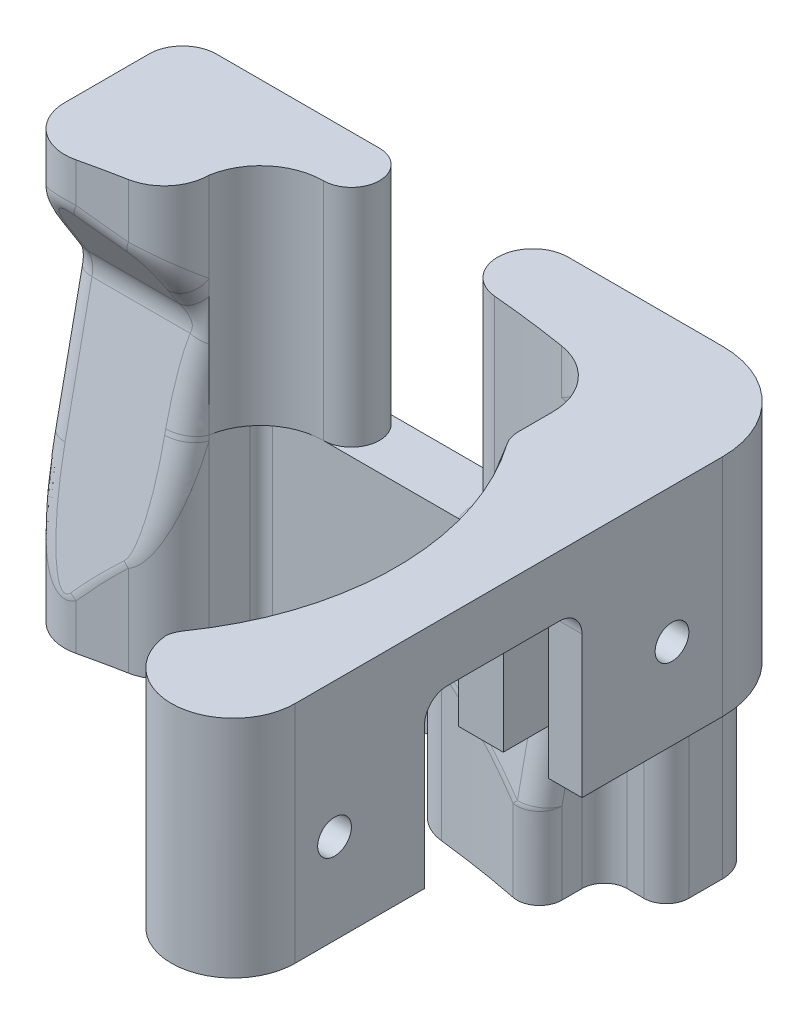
SolidWorks part; units mm, degrees
ref_plane "Front Plane" through (0, 0, 0) normal (0, 0, 1) x (1, 0, 0)
ref_plane "Top Plane" through (0, 0, 0) normal (0, 1, 0) x (1, 0, 0)
ref_plane "Right Plane" through (0, 0, 0) normal (1, 0, 0) x (0, 0, -1)
sketch "Sketch1" plane through (0, 0, 0) normal (0, 1, 0) x (1, 0, 0)
  line L0 (0, 0) -> (21, 0) construction
  line L1 (10.5, 0) -> (10.5, -4) construction
  line L2 (-2.25, 2) -> (-2.25, -5.844) construction
  line L3 (-2.25, 2) -> (23.25, 2) construction
  line L4 (23.25, 2) -> (23.25, -5.844) construction
  line L5 (-2.25, 0.5) -> (-2.25, -3.2459)
  line L6 (-0.75, 2) -> (21.75, 2)
  line L7 (3.75, -2.8217) -> (3.75, -1)
  line L8 (3.75, -0.5) -> (13.75, -0.5) construction
  line L9 (3.75, -0.5) -> (3.75, -4.5091) construction
  line L10 (13.75, -0.5) -> (13.75, -4.1175) construction
  line L11 (13.75, -1) -> (13.75, -2.2941)
  line L12 (4.25, -0.5) -> (13.25, -0.5)
  line L13 (23.25, 0.5) -> (23.25, -3.2459)
  circle A0 centre (0, 0) radius 1
  circle A1 centre (21, 0) radius 1
  arc A2 (-29.0259, -27.4894) -> (50.0259, -27.4894) centre (10.5, -49) cw construction
  arc A3 (-2.25, 0.5) -> (-0.75, 2) centre (-0.75, 0.5) cw
  arc A4 (21.75, 2) -> (23.25, 0.5) centre (21.75, 0.5) cw
  arc A5 (3.75, -1) -> (4.25, -0.5) centre (4.25, -1) cw
  arc A6 (13.25, -0.5) -> (13.75, -1) centre (13.25, -1) cw
  arc A7 (2.1223, -4.7867) -> (3.75, -2.8217) centre (1.75, -2.8217) ccw
  arc A8 (13.75, -2.2941) -> (15.5266, -4.2816) centre (15.75, -2.2941) ccw
  arc A9 (-2.25, -3.2459) -> (0.2074, -5.1929) centre (-0.25, -3.2459) ccw
  arc A10 (23.25, -3.2459) -> (20.7926, -5.1929) centre (21.25, -3.2459) cw
  arc A11 (0.2074, -5.1929) -> (2.1223, -4.7867) centre (10.5, -49) cw
  arc A12 (15.5266, -4.2816) -> (20.7926, -5.1929) centre (10.5, -49) cw
  dimension "D1" = 2
  dimension "D3" = 45
  dimension "D6" = 2.25
  dimension "D7" = 1.5
  dimension "D11" = 0.5
  dimension "D12" = 2
  dimension "D2" = 21
  dimension "D4" = 4
  dimension "D5" = 2
  dimension "D8" = 2.5
  dimension "D9" = 10
  dimension "D10" = 6
extrude "Boss-Extrude1" add sketch "Sketch1" along normal blind 8
sketch "Sketch2" plane through (0, 8, 0) normal (0, 1, 0) x (1, 0, 0)
  line L0 (-0.75, 2) -> (21.75, 2)
  line L2 (23.25, 0.5) -> (23.25, -3.2459)
  line L4 (13.75, -2.2941) -> (13.75, -1)
  line L6 (13.25, -0.5) -> (4.25, -0.5)
  line L7 (3.75, -1) -> (3.75, -2.8217)
  line L9 (-2.25, 0.5) -> (-2.25, -3.2459) construction
  line L10 (-2.25, -3.2459) -> (-2.25, 0.5)
  arc A0 (-2.25, 0.5) -> (-0.75, 2) centre (-0.75, 0.5) cw
  arc A1 (-2.25, -3.2459) -> (0.2074, -5.1929) centre (-0.25, -3.2459) ccw construction
  arc A2 (-0.75, 2) -> (-2.25, 0.5) centre (-0.75, 0.5) ccw construction
  arc A3 (21.75, 2) -> (23.25, 0.5) centre (21.75, 0.5) cw
  arc A4 (23.25, -3.2459) -> (20.7926, -5.1929) centre (21.25, -3.2459) cw
  arc A5 (20.7926, -5.1929) -> (15.5266, -4.2816) centre (10.5, -49) ccw
  arc A6 (15.5266, -4.2816) -> (13.75, -2.2941) centre (15.75, -2.2941) cw
  arc A7 (13.25, -0.5) -> (13.75, -1) centre (13.25, -1) cw
  arc A8 (4.25, -0.5) -> (3.75, -1) centre (4.25, -1) ccw
  arc A9 (3.75, -2.8217) -> (2.1223, -4.7867) centre (1.75, -2.8217) cw
  arc A10 (2.1223, -4.7867) -> (0.2074, -5.1929) centre (10.5, -49) ccw
  arc A11 (0.2074, -5.1929) -> (-2.25, -3.2459) centre (-0.25, -3.2459) cw
extrude "Boss-Extrude2" add sketch "Sketch2" along normal blind 1
sketch "Sketch3" plane through (0, 9, 0) normal (0, 1, 0) x (1, 0, 0)
  line L0 (24.5, -8.5) -> (24.5, -2)
  line L1 (24.5, -2) -> (22.5, -2)
  line L2 (22.5, -2) -> (22.5, -8.5)
  line L3 (24.5, -15.5) -> (24.5, -22)
  line L4 (24.5, -22) -> (22.5, -22)
  line L5 (22.5, -22) -> (22.5, -15.5)
  line L6 (20.5, -8.5) -> (20.5, 0) construction
  line L7 (20.5, 0) -> (26, 0) construction
  line L8 (26, 0) -> (26, -8.5) construction
  line L9 (26, -15.5) -> (26, -24) construction
  line L10 (26, -24) -> (20.5, -24) construction
  line L11 (20.5, -24) -> (20.5, -15.5) construction
  line L12 (20.5, -15.5) -> (22.5, -15.5)
  line L13 (24.5, -15.5) -> (26, -15.5)
  line L14 (26, -8.5) -> (24.5, -8.5)
  line L15 (22.5, -8.5) -> (20.5, -8.5)
  line L16 (24.5, -15.5) -> (24.5, -8.5) construction
  line L17 (24.5, -12) -> (50024.5, -12) construction
  line L18 (20.5, -2.8167) -> (20.5, -8.5)
  line L19 (-0.75, 2) -> (6.5, 2)
  line L20 (23.5, -3) -> (23.5, -50003) construction
  line L21 (0, 0) -> (21, 0) construction
  line L22 (10.5, 0) -> (10.5, -50000) construction
  line L26 (20.5, -15.5) -> (20.5, -21.25)
  line L27 (26, -15.5) -> (26, -21.25)
  line L28 (26, -2.25) -> (26, -8.5)
  line L29 (13.75, -1) -> (13.75, -2.2941) construction
  line L30 (21.75, 2) -> (-0.75, 2) construction
  line L31 (14.889, 2) -> (21.75, 2)
  line L32 (-2.25, 0.5) -> (-2.25, -3.2459)
  line L33 (4.25, -0.5) -> (13.25, -0.5) construction
  arc A0 (20.5, -2) -> (14.75, -1.1363) centre (10.5, -49) ccw construction
  arc A1 (-2.25, -3.2459) -> (0.2074, -5.1929) centre (-0.25, -3.2459) ccw
  arc A2 (-2.25, 0.5) -> (-0.75, 2) centre (-0.75, 0.5) cw
  arc A3 (21.75, 2) -> (26, -2.25) centre (21.75, -2.25) cw
  arc A5 (20.7926, -5.1929) -> (15.5266, -4.2816) centre (10.5, -49) ccw construction
  arc A7 (14.75, -1.1363) -> (14.889, 2) centre (14.889, 0.4288) cw
  arc A8 (19.6913, -1.8352) -> (20.5, -2.8167) centre (19.5, -2.8167) cw
  arc A9 (20.5, -21.25) -> (26, -21.25) centre (23.25, -21.25) ccw
  arc A10 (14.75, -1.1363) -> (19.6913, -1.8352) centre (10.5, -49) cw
  arc A11 (6.5, 2) -> (6.5, -0.5) centre (6.5, 0.75) cw
  arc A12 (3.75, -2.8217) -> (6.5, -0.5) centre (6.5, -3.2895) cw
  arc A16 (3.75, -2.8217) -> (2.1223, -4.7867) centre (1.75, -2.8217) cw
  arc A17 (2.1223, -4.7867) -> (0.2074, -5.1929) centre (10.5, -49) ccw
  arc A20 (2.1223, -4.7867) -> (0.2074, -5.1929) centre (10.5, -49) ccw construction
  point P17 (24.5, -12)
  point P24 (23.5, -2)
  point P29 (10.5, 0)
  dimension "D7" = 1
  dimension "D1" = 2
  dimension "D2" = 1.5
  dimension "D3" = 2
  dimension "D4" = 20
  dimension "D5" = 24
  dimension "D6" = 3.5
  dimension "D8" = 1
  dimension "D9" = 12
  dimension "D10" = 13
  dimension "D11" = 10
extrude "Boss-Extrude3" add sketch "Sketch3" along normal blind 8
sketch "Sketch4" plane through (0, 17, 0) normal (0, 1, 0) x (1, 0, 0)
  line L0 (20.5, -2.8167) -> (20.5, -21.25)
  line L1 (26, -21.25) -> (26, -2.25)
  line L2 (20.5, -2.8167) -> (20.5, -8.5) construction
  line L3 (14.889, 2) -> (21.75, 2)
  line L4 (21.75, 2) -> (14.889, 2) construction
  line L5 (-2.25, 0.5) -> (-2.25, -3.2459)
  line L7 (-0.75, 2) -> (6.5, 2)
  arc A0 (20.5, -2.8167) -> (19.6913, -1.8352) centre (19.5, -2.8167) ccw
  arc A1 (21.75, 2) -> (26, -2.25) centre (21.75, -2.25) cw
  arc A2 (26, -21.25) -> (20.5, -21.25) centre (23.25, -21.25) cw
  arc A3 (20.5, -21.25) -> (26, -21.25) centre (23.25, -21.25) ccw construction
  arc A4 (19.6913, -1.8352) -> (14.75, -1.1363) centre (10.5, -49) ccw
  arc A5 (14.75, -1.1363) -> (14.889, 2) centre (14.889, 0.4288) cw
  arc A6 (19.6913, -1.8352) -> (14.75, -1.1363) centre (10.5, -49) ccw construction
  arc A7 (26, -2.25) -> (21.75, 2) centre (21.75, -2.25) ccw construction
  arc A10 (6.5, -0.5) -> (3.75, -2.8217) centre (6.5, -3.2895) ccw
  arc A11 (3.75, -2.8217) -> (2.1223, -4.7867) centre (1.75, -2.8217) cw
  arc A12 (2.1223, -4.7867) -> (0.2074, -5.1929) centre (10.5, -49) ccw
  arc A13 (0.2074, -5.1929) -> (-2.25, -3.2459) centre (-0.25, -3.2459) cw
  arc A14 (-2.25, -3.2459) -> (0.2074, -5.1929) centre (-0.25, -3.2459) ccw construction
  arc A15 (-2.25, 0.5) -> (-0.75, 2) centre (-0.75, 0.5) cw
  arc A16 (6.5, 2) -> (6.5, -0.5) centre (6.5, 0.75) cw
  arc A17 (2.1223, -4.7867) -> (3.75, -2.8217) centre (1.75, -2.8217) ccw construction
extrude "Boss-Extrude4" add sketch "Sketch4" along normal blind 2
sketch "Sketch5" plane through (20.5, 0, 0) normal (-1, 0, 0) x (0, 0, 1)
  line L0 (4.5, 13) -> (19.5, 13) construction
  line L1 (8.5, 9) -> (15.5, 9) construction
  line L2 (12, 9) -> (12, 17) construction
  line L3 (8.5, 17) -> (15.5, 17) construction
  circle A0 centre (19.5, 13) radius 0.75
  circle A1 centre (4.5, 13) radius 0.75
  point P12 (12, 13)
  point P13 (12, 13)
  dimension "D2" = 1.5
  dimension "D1" = 15
extrude "Cut-Extrude1" cut sketch "Sketch5" against normal through all
fillet "Fillet1" radius 1 4 edges at (17.2297, 9, 1.4215) (20.5, 9, 3.9709) (20.2718, 9, 2.1808)
sketch "Sketch6" plane through (20.5, 0, 0) normal (-1, 0, 0) x (0, 0, 1)
  circle A0 centre (19.5, 13) radius 1.25
  circle A1 centre (4.5, 13) radius 1.25
  dimension "D1" = 2.5
extrude "Cut-Extrude2" cut sketch "Sketch6" against normal up to surface (2 mm away)
sketch "Sketch7" plane through (20.5, 0, 0) normal (-1, 0, 0) x (0, 0, 1)
  line L0 (3.2306, 13.7992) -> (5.2459, 17)
  line L2 (5.2459, 0) -> (5.2459, 19) construction
  line L3 (3.0312, 12.6959) -> (5.2459, 2)
  line L4 (5.2459, 17) -> (5.2459, 2)
  line L7 (3.2459, 0) -> (5.2459, 0) construction
  line L8 (5.2459, 19) -> (3.2459, 19) construction
  arc A0 (5.2459, 14.3014) -> (5.2459, 11.6986) centre (4.5, 13) ccw construction
  arc A1 (3.0312, 12.6959) -> (3.2306, 13.7992) centre (4.5, 13) cw
  dimension "D1" = 3
  dimension "D2" = 2
  dimension "D3" = 2
extrude "Cut-Extrude3" cut sketch "Sketch7" along normal through all
fillet "Fillet3" radius 1 13 edges at (18.0251, 4.9568, 4.6337) (20.2071, 9.2929, 3.7358) (1.1627, 16.5767, 4.9794) (3.1509, 15.4167, 4.249) (3.2212, 7.1646, 4.1765) (1.1627, 3.2871, 4.9794) (-1.492, 4.0881, 4.8135) (-2.25, 12.1773, 3.1385) (-2.25, 13.2669, 3.0239) (-2.25, 13.8113, 3.2383) (14.9409, 7.422, 4.1232) (16.9649, 9, 3.7964) (-1.492, 16.3133, 4.8135)
sketch "Sketch14" plane through (0, 17, 0) normal (0, -1, 0) x (1, 0, 0)
  line L0 (20.5, 15.5) -> (22.5, 15.5)
  line L1 (22.5, 15.5) -> (22.5, 22)
  line L2 (22.5, 22) -> (24.5, 22)
  line L3 (24.5, 22) -> (24.5, 15.5)
  line L4 (24.5, 15.5) -> (26, 15.5)
  line L5 (26, 15.5) -> (26, 8.5)
  line L6 (26, 8.5) -> (24.5, 8.5)
  line L7 (24.5, 8.5) -> (24.5, 2)
  line L8 (24.5, 2) -> (22.5, 2)
  line L9 (22.5, 2) -> (24.5, 2) construction
  line L10 (22.5, 2) -> (22.5, 8.5)
  line L11 (22.5, 8.5) -> (20.5, 8.5)
  line L12 (20.5, 8.5) -> (20.5, 15.5)
extrude "Boss-Extrude8" add sketch "Sketch14" along normal blind 0.7
sketch "Sketch8" plane through (0, 19, 0) normal (0, 1, 0) x (1, 0, 0)
  line L0 (0, 0) -> (21, 0) construction
  line L2 (10.5, 0) -> (10.5, -13.75) construction
  line L6 (16.5, -2.7841) -> (16.5, -24.7159)
  line L9 (20.5, -13.75) -> (23, -13.75) construction
  line L10 (20.5, -2.8167) -> (20.5, -21.25) construction
  line L13 (20.5, -13.75) -> (16.5, -13.75) construction
  circle A0 centre (10.5, -13.75) radius 12.5 construction
  arc A4 (16.5, -2.7841) -> (16.5, -24.7159) centre (10.5, -13.75) cw
  dimension "D1" = 13.75
  dimension "D2" = 25
  dimension "D3" = 4
extrude "Cut-Extrude4" cut sketch "Sketch8" against normal blind 10 draft 20
sketch "Sketch10" plane through (0, 19, 0) normal (0, 1, 0) x (1, 0, 0)
  line L1 (20.5, -2.8167) -> (20.5, -6.25) construction
  line L2 (20.5, -2.8167) -> (20.5, -4.3167)
  arc A0 (18.1536, -1.5614) -> (20.5, -4.3167) centre (17.709, -4.3167) cw
  arc A4 (19.6913, -1.8352) -> (20.5, -2.8167) centre (19.5, -2.8167) cw
  arc A7 (19.6913, -1.8352) -> (14.75, -1.1363) centre (10.5, -49) ccw construction
  arc A8 (20.5, -2.8167) -> (19.6913, -1.8352) centre (19.5, -2.8167) ccw construction
  arc A9 (18.1536, -1.5614) -> (19.6913, -1.8352) centre (10.5, -49) cw
  dimension "D1" = 1.5
extrude "Boss-Extrude5" add sketch "Sketch10" against normal blind 2
fillet "Fillet10" radius 1 2 edges at (20.5, 14.5203, 18.0099)
fillet "Fillet11" radius 1 1 edges at (19.8339, 17, 2.5072)
fillet "Fillet12" radius 1 4 edges at (25.25, 16.3, 15.5) (25.25, 16.3, 8.5) (21.6256, 16.3, 8.5) (22.1918, 16.3, 15.5)
sketch "Sketch15" plane through (0, 9, 0) normal (0, -1, 0) x (1, 0, 0)
  line L0 (24.5, 8.5) -> (20.5, 8.5)
  line L1 (24.5, 8.5) -> (24.5, 2)
  line L2 (20.5, 8.5) -> (20.5, 2)
  line L3 (20.5, 8.5) -> (22.5, 8.5) construction
  line L4 (20.5, 2) -> (24.5, 2)
  line L5 (20.5, 5.1252) -> (20.5, 8.5) construction
extrude "Cut-Extrude5" cut sketch "Sketch15" along normal through all
fillet "Fillet13" radius 1 4 edges at (20.5, 5.6376, 4.4927) (23.25, 4.5, 2) (20.5, 1.1799, 5.1252)
fillet "Fillet14" radius 1 1 edges at (20.5, 4.5, 2)
